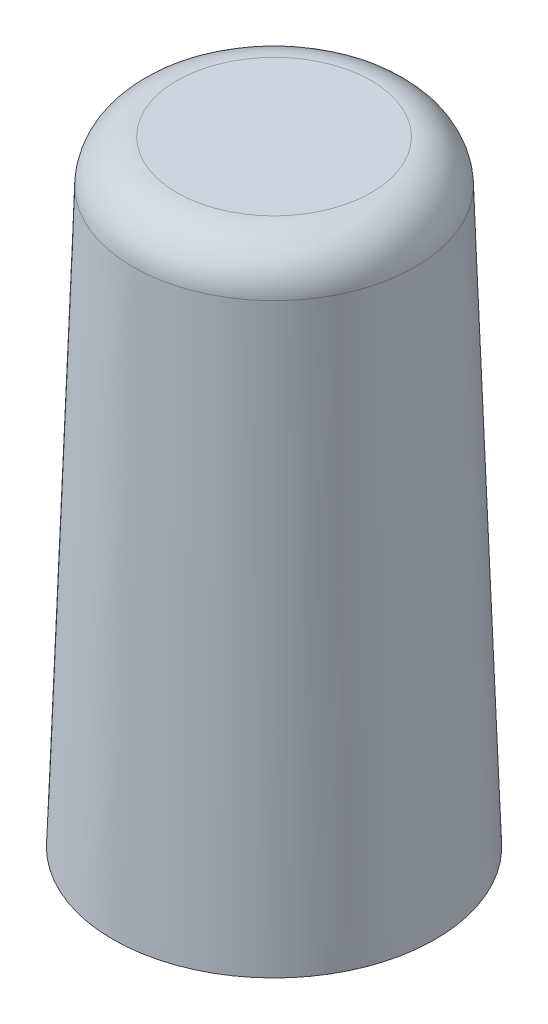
SolidWorks part; units mm, degrees
ref_plane "Front Plane" through (0, 0, 0) normal (0, 0, 1) x (1, 0, 0)
ref_plane "Top Plane" through (0, 0, 0) normal (0, 1, 0) x (1, 0, 0)
ref_plane "Right Plane" through (0, 0, 0) normal (1, 0, 0) x (0, 0, -1)
sketch "Sketch1" plane through (0, 0, 0) normal (0, 1, 0) x (1, 0, 0)
  circle A0 centre (0, 0) radius 11
  dimension "D1" = 22
extrude "Boss-Extrude1" add sketch "Sketch1" along normal blind 42 draft 2
fillet "Fillet1" radius 3 1 edges at (0, 42, 9.5333)
